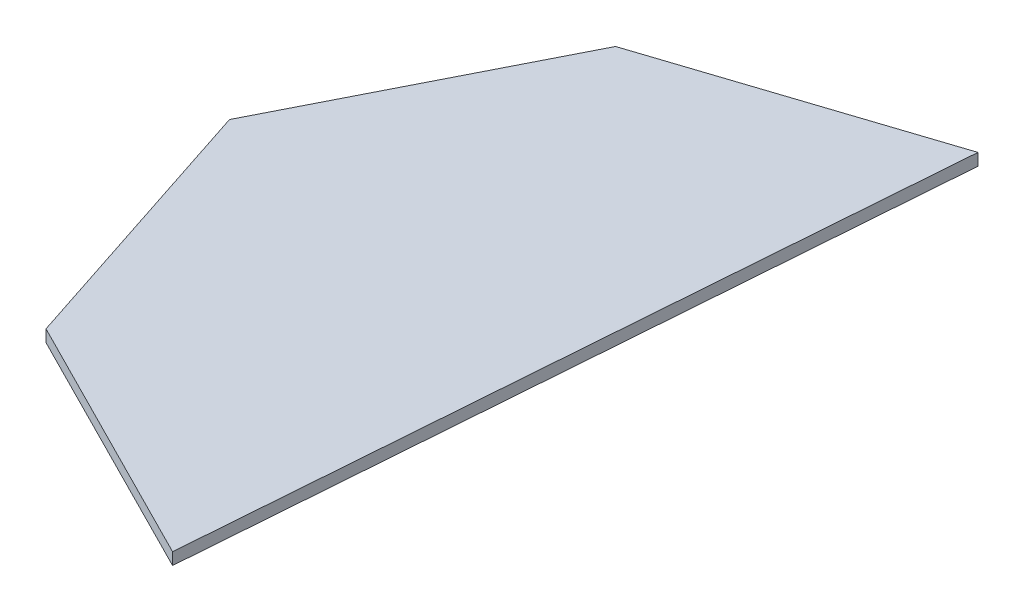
SolidWorks part; units mm, degrees
ref_plane "Front" through (0, 0, 0) normal (0, 0, 1) x (1, 0, 0)
ref_plane "Top" through (0, 0, 0) normal (0, 1, 0) x (1, 0, 0)
ref_plane "Right" through (0, 0, 0) normal (1, 0, 0) x (0, 0, -1)
sketch "Sketch1" plane through (0, 0, 0) normal (0, 1, 0) x (1, 0, 0)
  line L0 (28.5144, 375) -> (-28.5144, -375)
  line L1 (28.5144, 375) -> (-245.0024, 285.3277)
  line L2 (-245.0024, 285.3277) -> (-375, 28.5144)
  line L3 (-375, 28.5144) -> (-285.3277, -245.0024)
  line L4 (-285.3277, -245.0024) -> (-28.5144, -375)
  line L10 (285.3277, 245.0024) -> (156.921, 310.0012)
  line L11 (375, -28.5144) -> (330.1639, 108.244)
  line L12 (245.0024, -285.3277) -> (310.0012, -156.921)
  line L13 (-28.5144, -375) -> (108.244, -330.1639)
  arc A0 (26.3438, 346.4548) -> (-26.3438, -346.4548) centre (0, 0) ccw construction
  dimension "D1" = 750
extrude "Boss-Extrude1" add sketch "Sketch1" along normal blind 12 contours L3 L4 L0 L1 L2
